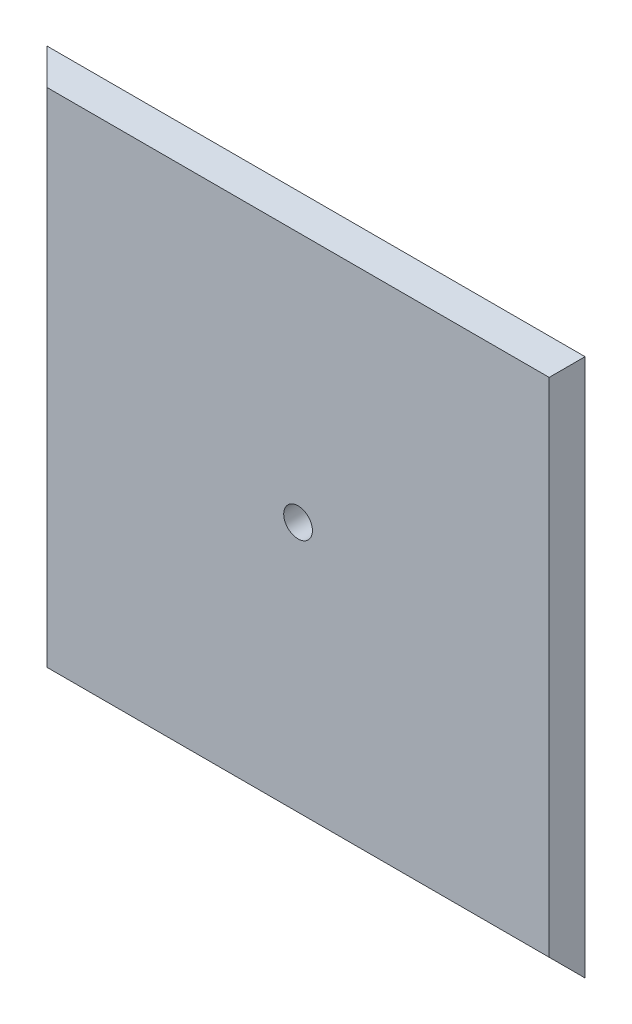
SolidWorks part; units mm, degrees
ref_plane "Ebene vorne" through (0, 0, 0) normal (0, 0, 1) x (1, 0, 0)
ref_plane "Ebene oben" through (0, 0, 0) normal (0, 1, 0) x (1, 0, 0)
ref_plane "Ebene rechts" through (0, 0, 0) normal (1, 0, 0) x (0, 0, -1)
sketch "Skizze1" plane through (0, 0, 0) normal (0, 0, 1) x (1, 0, 0)
  line L0 (-75, 75) -> (75, -75) construction
  line L1 (-75, 75) -> (75, 75)
  line L2 (-75, 75) -> (-75, -75)
  line L3 (-75, -75) -> (75, -75)
  line L4 (75, 75) -> (75, -75)
  circle A0 centre (0, 0) radius 4
  dimension "D1" = 150
  dimension "D2" = 8
extrude "Aufsatz-Linear austragen1" add sketch "Skizze1" along normal blind 10
chamfer "Fase1" distance 5 angle 45 8 edges at (0, -75, 0) (75, 0, 0) (0, 75, 0) (-75, 0, 0) (0, 75, 10) (75, 0, 10) (0, -75, 10) (-75, 0, 10)
